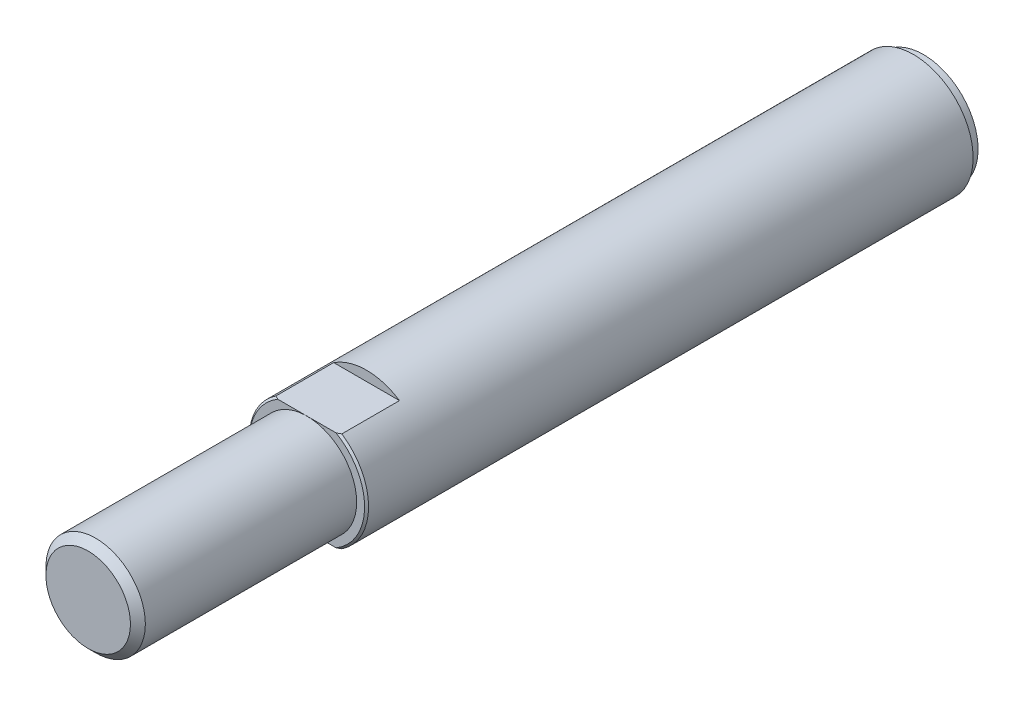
SolidWorks part; units mm, degrees
ref_plane "Plano frontal" through (0, 0, 0) normal (0, 0, 1) x (1, 0, 0)
ref_plane "Plano superior" through (0, 0, 0) normal (0, 1, 0) x (1, 0, 0)
ref_plane "Plano direito" through (0, 0, 0) normal (1, 0, 0) x (0, 0, -1)
sketch "Esboço1" plane through (0, 0, 0) normal (0, 0, 1) x (1, 0, 0)
  circle A0 centre (0, 0) radius 6
  dimension "D1" = 12
extrude "Ressalto-extrusão1" add sketch "Esboço1" along normal blind 84
sketch "Esboço2" plane through (0, 0, 84) normal (0, 0, 1) x (1, 0, 0)
  circle A0 centre (0, 0) radius 5
  dimension "D1" = 10
extrude "Corte-extrusão1" cut sketch "Esboço2" against normal blind 22 flip side to cut
hole_wizard "Furo roscado de M6x1.01" positions "Esboço3" profile "Esboço4" tap size "M6x1.0" standard "Ansi Metric"
sketch "Esboço3" plane through (0, 0, 0) normal (0, 0, -1) x (-1, 0, 0)
  point P0 (0, 0)
sketch "Esboço4" plane through (0, 0, 0) normal (1, 0, 0) x (0, 1, 0)
  line L0 (0, 0) -> (0, 18.5022)
  line L1 (0, 18.5022) -> (2.5, 17)
  line L2 (2.5, 17) -> (2.5, 0)
  line L5 (2.5, 0) -> (0, 0)
  line L10 (0, 18.5022) -> (-2.5, 17) construction
  line L11 (0, -6.35) -> (0, 107.95) construction
  dimension "Tap Drill Dia." = 5
  dimension "Tap Drill Depth" = 17
  dimension "Drill Angle" = 118
sketch "Esboço5" plane through (0, 0, 0) normal (0, 0, -1) x (-1, 0, 0)
  circle A0 centre (0, 0) radius 5.5
  dimension "D1" = 11
extrude "Corte-extrusão2" cut sketch "Esboço5" against normal blind 1 flip side to cut
chamfer "Chanfro1" distance 0.2 angle 45 1 edges at (6, 0, 62)
chamfer "Chanfro2" distance 0.75 angle 45 1 edges at (5, 0, 84)
sketch "Esboço6" plane through (0, 0, 62) normal (0, 0, 1) x (1, 0, 0)
  line L1 (-8.7858, -5.005) -> (8.7858, -5.005)
  line L2 (-8.7858, -5.005) -> (-8.7858, 5.005)
  line L3 (-8.7858, 5.005) -> (8.7858, 5.005)
  line L4 (8.7858, -5.005) -> (8.7858, 5.005)
  line L5 (-8.7858, -5.005) -> (8.7858, 5.005) construction
  line L6 (-8.7858, 5.005) -> (8.7858, -5.005) construction
  point P0 (0, 0)
  dimension "D1" = 10.01
extrude "Corte-extrusão3" cut sketch "Esboço6" against normal blind 6 flip side to cut
